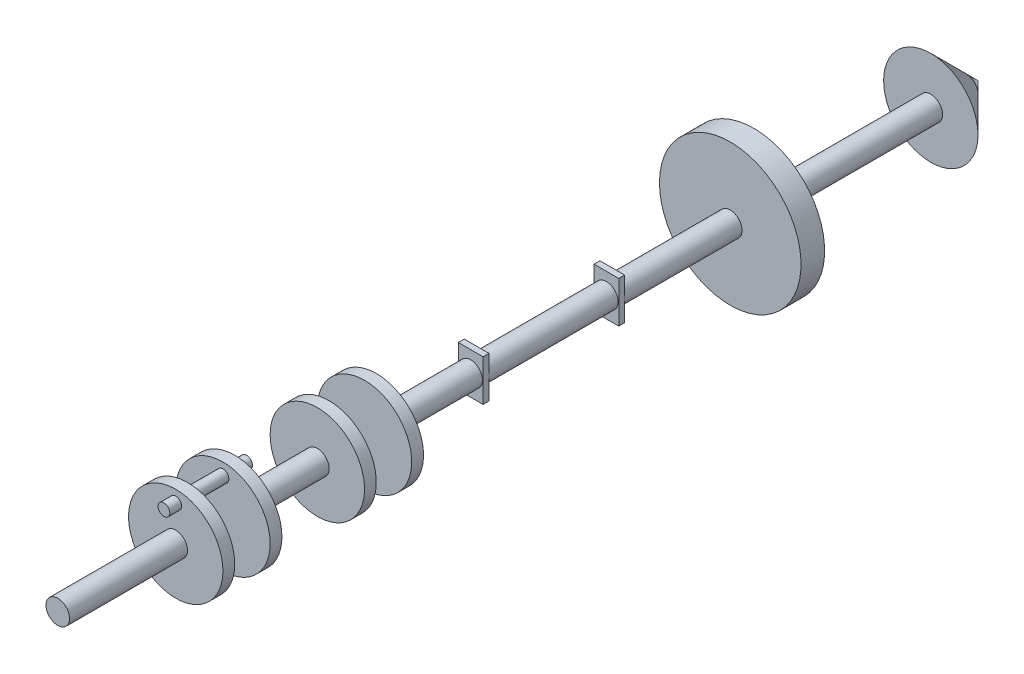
SolidWorks part; units mm, degrees
ref_plane "Plan de face" through (0, 0, 0) normal (0, 0, 1) x (1, 0, 0)
ref_plane "Plan de dessus" through (0, 0, 0) normal (0, 1, 0) x (1, 0, 0)
ref_plane "Plan de droite" through (0, 0, 0) normal (1, 0, 0) x (0, 0, -1)
sketch "Esquisse1" plane through (0, 0, 0) normal (0, 0, 1) x (1, 0, 0)
  circle A0 centre (0, 0) radius 10
  dimension "D1" = 20
extrude "Extrusion1" add sketch "Esquisse1" along normal blind 200
sketch "Esquisse2" plane through (0, 0, 0) normal (0, 0, -1) x (-1, 0, 0)
  line L1 (-10.5, 17.5) -> (10.5, 17.5)
  line L2 (-10.5, 17.5) -> (-10.5, -17.5)
  line L3 (-10.5, -17.5) -> (10.5, -17.5)
  line L4 (10.5, 17.5) -> (10.5, -17.5)
  dimension "D1" = 21
  dimension "D2" = 10.5
  dimension "D3" = 35
  dimension "D4" = 17.5
extrude "Extrusion2" add sketch "Esquisse2" along normal blind 5
sketch "Esquisse3" plane through (0, 0, -5) normal (0, 0, -1) x (-1, 0, 0)
  circle A0 centre (0, 0) radius 10 construction
  circle A1 centre (0, 0) radius 10
extrude "Extrusion3" add sketch "Esquisse3" along normal blind 110
sketch "Esquisse4" plane through (0, 0, -115) normal (0, 0, -1) x (-1, 0, 0)
  line L4 (-10.5, 17.5) -> (-10.5, -17.5)
  line L5 (-10.5, -17.5) -> (10.5, -17.5)
  line L6 (10.5, -17.5) -> (10.5, 17.5)
  line L7 (10.5, 17.5) -> (-10.5, 17.5)
  line L8 (-10.5, 17.5) -> (-10.5, -17.5)
  line L9 (-10.5, -17.5) -> (10.5, -17.5)
  line L10 (10.5, -17.5) -> (10.5, 17.5)
  line L11 (10.5, 17.5) -> (-10.5, 17.5)
  dimension "D1" = 0
extrude "Extrusion4" add sketch "Esquisse4" along normal blind 5
sketch "Esquisse5" plane through (0, 0, -120) normal (0, 0, -1) x (-1, 0, 0)
  circle A0 centre (0, 0) radius 10 construction
  circle A1 centre (0, 0) radius 10
extrude "Extrusion5" add sketch "Esquisse5" along normal blind 100
sketch "Esquisse6" plane through (0, 0, -220) normal (0, 0, -1) x (-1, 0, 0)
  circle A0 centre (0, 0) radius 60
  dimension "D1" = 120
extrude "Extrusion6" add sketch "Esquisse6" along normal blind 20
sketch "Esquisse7" plane through (0, 0, 200) normal (0, 0, 1) x (1, 0, 0)
  circle A0 centre (0, 0) radius 40
  dimension "D1" = 80
extrude "Extrusion7" add sketch "Esquisse7" along normal blind 10
sketch "Esquisse8" plane through (0, 0, 200) normal (0, 0, -1) x (-1, 0, 0)
  circle A0 centre (0, 30) radius 5
  dimension "D1" = 10
  dimension "D2" = 30
extrude "Extrusion8" add sketch "Esquisse8" along normal blind 10
sketch "Esquisse9" plane through (0, 0, 210) normal (0, 0, 1) x (1, 0, 0)
  circle A0 centre (0, 30) radius 5 construction
  circle A1 centre (0, 30) radius 5
extrude "Extrusion9" add sketch "Esquisse9" along normal blind 30
sketch "Esquisse10" plane through (0, 0, 240) normal (0, 0, 1) x (1, 0, 0)
  circle A0 centre (0, 0) radius 40 construction
  circle A1 centre (0, 0) radius 40
extrude "Extrusion10" add sketch "Esquisse10" along normal blind 10
sketch "Esquisse11" plane through (0, 0, 250) normal (0, 0, 1) x (1, 0, 0)
  circle A0 centre (0, 30) radius 5 construction
  circle A1 centre (0, 30) radius 5
extrude "Extrusion11" add sketch "Esquisse11" along normal blind 10
sketch "Esquisse12" plane through (0, 0, 250) normal (0, 0, 1) x (1, 0, 0)
  circle A0 centre (0, 0) radius 10 construction
  circle A1 centre (0, 0) radius 10
extrude "Extrusion12" add sketch "Esquisse12" along normal blind 100
sketch "Esquisse13" plane through (0, 0, -240) normal (0, 0, -1) x (-1, 0, 0)
  circle A0 centre (0, 0) radius 10 construction
  circle A1 centre (0, 0) radius 10
extrude "Extrusion13" add sketch "Esquisse13" along normal blind 150
sketch "Esquisse14" plane through (0, 0, 0) normal (1, 0, 0) x (0, 0, -1)
  line L0 (390, 0) -> (390, 40)
  line L1 (390, -10) -> (390, 10) construction
  line L2 (390, 40) -> (430, 0)
  line L3 (430, 0) -> (390, 0)
  dimension "D1" = 40
  dimension "D2" = 40
revolve "Révolution1" add sketch "Esquisse14" angle 360 about L3
sketch "Esquisse15" plane through (0, 0, 0) normal (1, 0, 0) x (0, 0, -1)
  line L0 (0, 0) -> (-160.4574, 0) construction
  line L1 (0, 17.5) -> (0, -17.5) construction
  line L3 (-130, 0) -> (-120, 0)
  line L4 (-130, 0) -> (-130, 40)
  line L5 (-130, 40) -> (-120, 40)
  line L6 (-120, 0) -> (-120, 40)
  line L7 (-90, 0) -> (-80, 0)
  line L8 (-90, 0) -> (-90, 40)
  line L9 (-90, 40) -> (-80, 40)
  line L10 (-80, 0) -> (-80, 40)
  line L11 (-200, -40) -> (-200, 40) construction
  dimension "D1" = 10
  dimension "D2" = 10
  dimension "D3" = 30
  dimension "D4" = 70
  dimension "D5" = 40
  dimension "D6" = 40
revolve "Révolution2" add sketch "Esquisse15" angle 360 about L0
sketch "Esquisse16" plane through (0, 0, 0) normal (1, 0, 0) x (0, 0, -1)
  line L0 (-120, -40) -> (-120, 40) construction
  line L1 (-120, 17.3557) -> (-90, 17.3557)
  line L2 (-120, 17.3557) -> (-120, -21.8709)
  line L3 (-120, -21.8709) -> (-90, -21.8709)
  line L4 (-90, 17.3557) -> (-90, -21.8709)
  line L5 (-90, 40) -> (-90, -40) construction
extrude "Enlèv. mat.-Extru.1" cut sketch "Esquisse16" against normal through all and the other way through all
